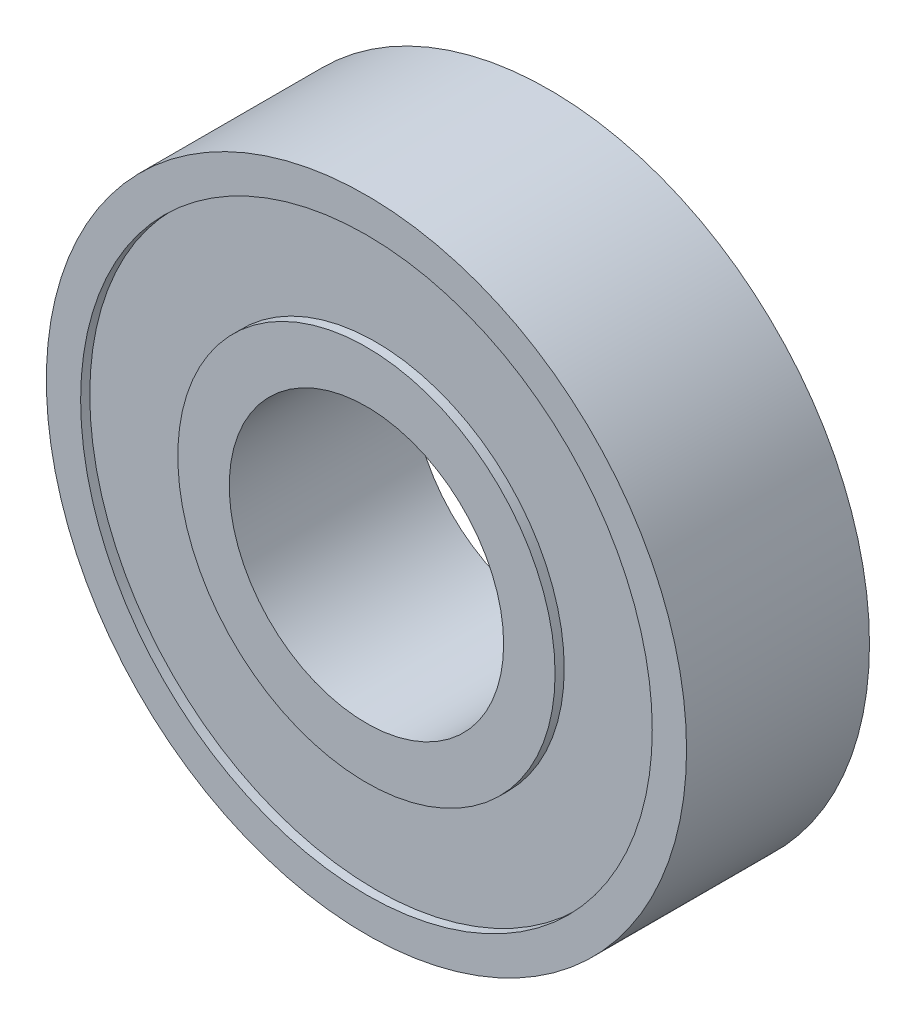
SolidWorks part; units mm, degrees
ref_plane "Front" through (0, 0, 0) normal (0, 0, 1) x (1, 0, 0)
ref_plane "Top" through (0, 0, 0) normal (0, 1, 0) x (1, 0, 0)
ref_plane "Right" through (0, 0, 0) normal (1, 0, 0) x (0, 0, -1)
sketch "Sketch1" plane through (0, 0, 0) normal (0, 0, 1) x (1, 0, 0)
  circle A0 centre (0, 0) radius 14
  circle A1 centre (0, 0) radius 6
  dimension "D1" = 28
  dimension "D2" = 12
extrude "Extrude1" add sketch "Sketch1" along normal mid plane 8
sketch "Sketch2" plane through (0, 0, 4) normal (0, 0, 1) x (1, 0, 0)
  circle A2 centre (0, 0) radius 8.25
  circle A3 centre (0, 0) radius 8.25
  circle A5 centre (0, 0) radius 12.5
  circle A6 centre (0, 0) radius 12.5
  dimension "D1" = 2.25
  dimension "D2" = 1.5
extrude "Cut-Extrude1" cut sketch "Sketch2" against normal blind 0.4
mirror "Mirror1" about plane through (0, 0, 0) normal (0, 0, 1) of "Cut-Extrude1"
